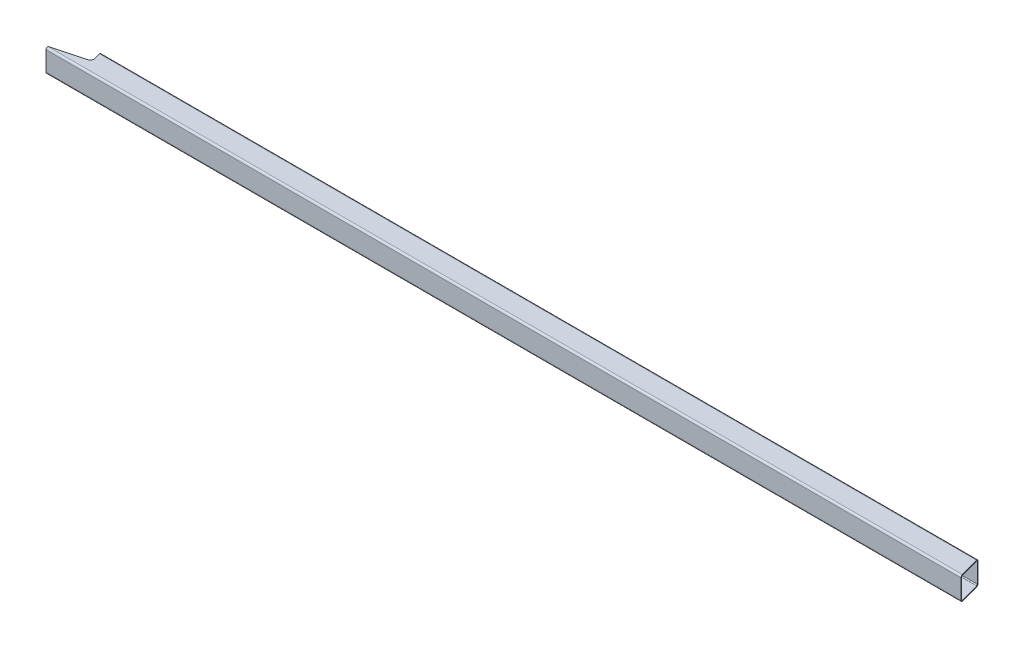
SolidWorks part; units mm, degrees
ref_plane "Front Plane" through (0, 0, 0) normal (1, 0, 0) x (0, 1, 0)
ref_plane "Top Plane" through (0, 0, 0) normal (0, 0, 1) x (0, 1, 0)
ref_plane "Right Plane" through (0, 0, 0) normal (0, 1, 0) x (-1, 0, 0)
sketch "sk 3x3x0.12" plane through (0, 0, 0) normal (1, 0, 0) x (0, 1, 0)
  line L4 (-32.004, -38.1) -> (32.004, -38.1)
  line L5 (-38.1, -32.004) -> (-38.1, 32.004)
  line L6 (32.004, 38.1) -> (-32.004, 38.1)
  line L7 (38.1, 32.004) -> (38.1, -32.004)
  line L8 (35.052, 32.004) -> (35.052, -32.004)
  line L9 (-32.004, -35.052) -> (32.004, -35.052)
  line L10 (38.1, 0) -> (-38.1, 0) construction
  line L11 (-35.052, -32.004) -> (-35.052, 32.004)
  line L12 (32.004, 35.052) -> (-32.004, 35.052)
  arc A0 (38.1, 32.004) -> (32.004, 38.1) centre (32.004, 32.004) ccw
  arc A1 (32.004, -38.1) -> (38.1, -32.004) centre (32.004, -32.004) ccw
  arc A2 (-38.1, -32.004) -> (-32.004, -38.1) centre (-32.004, -32.004) ccw
  arc A3 (-32.004, 38.1) -> (-38.1, 32.004) centre (-32.004, 32.004) ccw
  arc A8 (32.004, -35.052) -> (35.052, -32.004) centre (32.004, -32.004) ccw
  arc A9 (-35.052, -32.004) -> (-32.004, -35.052) centre (-32.004, -32.004) ccw
  arc A10 (-32.004, 35.052) -> (-35.052, 32.004) centre (-32.004, 32.004) ccw
  arc A11 (35.052, 32.004) -> (32.004, 35.052) centre (32.004, 32.004) ccw
  point P2 (0, 0)
  point P27 (0, -35.052)
  point P28 (0, 35.052)
  point P29 (-35.052, 0)
  point P30 (35.052, 0)
extrude "Boss-Extrude1" add sketch "sk 3x3x0.12" along normal blind 3048
sketch "roof sk" plane through (0, 0, 0) normal (0, 1, 0) x (-1, 0, 0)
  line L0 (-3048, 38.1) -> (0, 38.1) construction
  line L1 (39.8761, 39.6875) -> (39.8761, 239.6875)
  line B0 (39.8761, 38.1) -> (39.8761, 39.6875)
  line B1 (-3008.1239, 39.6875) -> (39.8761, 39.6875)
  line B2 (-3008.1239, 38.1) -> (39.8761, 38.1)
  line B3 (20.3281, 37.4509) -> (-139.1463, -5.2801)
  line B4 (-152.6167, -28.6115) -> (-109.8857, -188.0859)
  line B5 (86.3905, -135.4939) -> (43.6594, 23.9805)
  line B6 (-143.4162, -26.1463) -> (-100.6852, -185.6206)
  line B7 (77.19, -137.9591) -> (34.459, 21.5153)
  line B8 (22.7933, 28.2504) -> (-136.681, -14.4806)
  arc B9 (43.6594, 23.9805) -> (20.3281, 37.4509) centre (25.2586, 19.05) ccw
  arc B10 (-139.1463, -5.2801) -> (-152.6167, -28.6115) centre (-134.2158, -23.681) ccw
  arc B11 (-136.681, -14.4806) -> (-143.4162, -26.1463) centre (-134.2158, -23.681) ccw
  line B12 (39.8761, 241.275) -> (-3008.1239, 241.275)
  line B13 (39.8761, 239.6875) -> (-3008.1239, 239.6875)
  line B14 (39.8761, 39.6875) -> (-3008.1239, 39.6875)
  line B15 (42.3983, 28.687) -> (75.2684, -93.9856)
  line B16 (-71.9387, -133.4296) -> (-104.8087, -10.757)
  line B17 (-95.8285, 4.7972) -> (26.8441, 37.6673)
  line B18 (66.2881, -109.5398) -> (-56.3845, -142.4099)
  line B19 (39.8761, 38.1) -> (-3008.1239, 38.1)
  line B20 (39.8761, 39.6875) -> (39.8761, 38.1)
  line B21 (-3008.1239, 38.1) -> (-3008.1239, 39.6875)
  arc B22 (42.3983, 28.687) -> (26.8441, 37.6673) centre (30.1311, 25.4) ccw
  arc B23 (66.2881, -109.5398) -> (75.2684, -93.9856) centre (63.0011, -97.2726) ccw
  arc B24 (-95.8285, 4.7972) -> (-104.8087, -10.757) centre (-92.5415, -7.47) ccw
  arc B25 (-71.9387, -133.4296) -> (-56.3845, -142.4099) centre (-59.6715, -130.1426) ccw
sketch_block_instance "Block1-3"
sketch_block "Block1"
sketch_block_instance "midroof-1"
sketch_block "midroof"
sketch_block_instance "Block2-1"
sketch_block "Block2"
sketch "Sketch5" plane through (0, 0, 0) normal (0, 1, 0) x (-1, 0, 0)
  line L0 (-87.5775, -102.1108) -> (-111.9526, -11.1416)
  line L1 (20.3281, 37.4509) -> (-139.1463, -5.2801) construction
  line L2 (20.3281, 37.4509) -> (-102.9724, 4.4126)
  line L4 (-87.5775, -102.1108) -> (20.3281, -73.1976)
  line L5 (20.3281, -73.1976) -> (20.3281, 37.4509)
  line L6 (-71.9387, -133.4296) -> (-104.8087, -10.757) construction
  arc A0 (-102.9724, 4.4126) -> (-111.9526, -11.1416) centre (-99.6854, -7.8546) ccw
  dimension "D1" = 7
  dimension "D2" = 12.7
extrude "Cut-Extrude1" cut sketch "Sketch5" against normal through all both and the other way through all
sketch "Sketch6" plane through (0, 0, 0) normal (0, 1, 0) x (-1, 0, 0)
  line L0 (-3025.043, 102.8306) -> (-2974.1149, -87.2356) construction
  line L1 (-3008.1239, 39.6875) -> (39.8761, 39.6875) construction
  line L2 (-3031.8982, 106.1982) -> (-3077.0484, 106.1982)
  line L3 (-3077.0484, 106.1982) -> (-3077.0484, -83.868)
  line L4 (-3077.0484, -83.868) -> (-2980.9701, -83.868)
  line L5 (-3031.8982, 106.1982) -> (-2980.9701, -83.868)
  dimension "D1" = 105
  dimension "D2" = 11.5
extrude "Cut-Extrude2" cut sketch "Sketch6" against normal through all both and the other way through all
